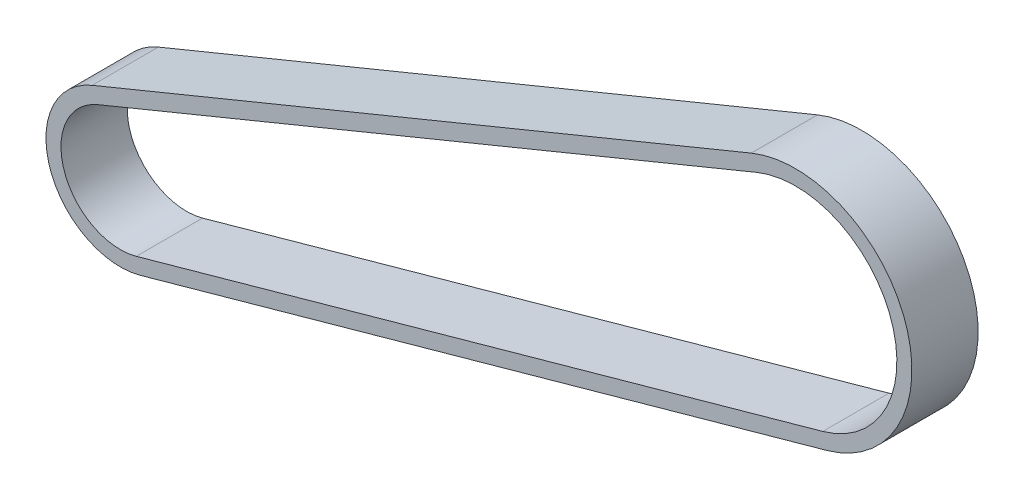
SolidWorks part; units mm, degrees
ref_plane "Front Plane" through (0, 0, 0) normal (0, 0, 1) x (1, 0, 0)
ref_plane "Top Plane" through (0, 0, 0) normal (0, 1, 0) x (1, 0, 0)
ref_plane "Right Plane" through (0, 0, 0) normal (1, 0, 0) x (0, 0, -1)
sketch "Sketch1"
sketch_block_instance "Block1-1"
sketch_block "Block1"
sketch "Sketch2" plane through (0, 0, 0) normal (0, 0, 1) x (1, 0, 0)
  line L0 (-63.194, -16.0428) -> (-3.4897, 8.4919)
  line L1 (-59.7043, -26.1962) -> (2.4682, -8.843)
  line L2 (-59.3387, -27.5061) -> (2.8338, -10.1529)
  line L3 (-63.7109, -14.7849) -> (-4.0066, 9.7499)
  arc A0 (-63.194, -16.0428) -> (-59.7043, -26.1962) centre (-61.15, -21.0167) ccw
  arc A1 (2.4682, -8.843) -> (-3.4897, 8.4919) centre (0, 0) ccw
  circle A2 centre (0, 0) radius 9.181 construction
  circle A3 centre (-61.15, -21.0167) radius 5.3775 construction
  arc A4 (-63.7109, -14.7849) -> (-59.3387, -27.5061) centre (-61.15, -21.0167) ccw
  arc A5 (2.8338, -10.1529) -> (-4.0066, 9.7499) centre (0, 0) ccw
  dimension "D1" = 1.36
extrude "Boss-Extrude1" add sketch "Sketch2" along normal mid plane 6
